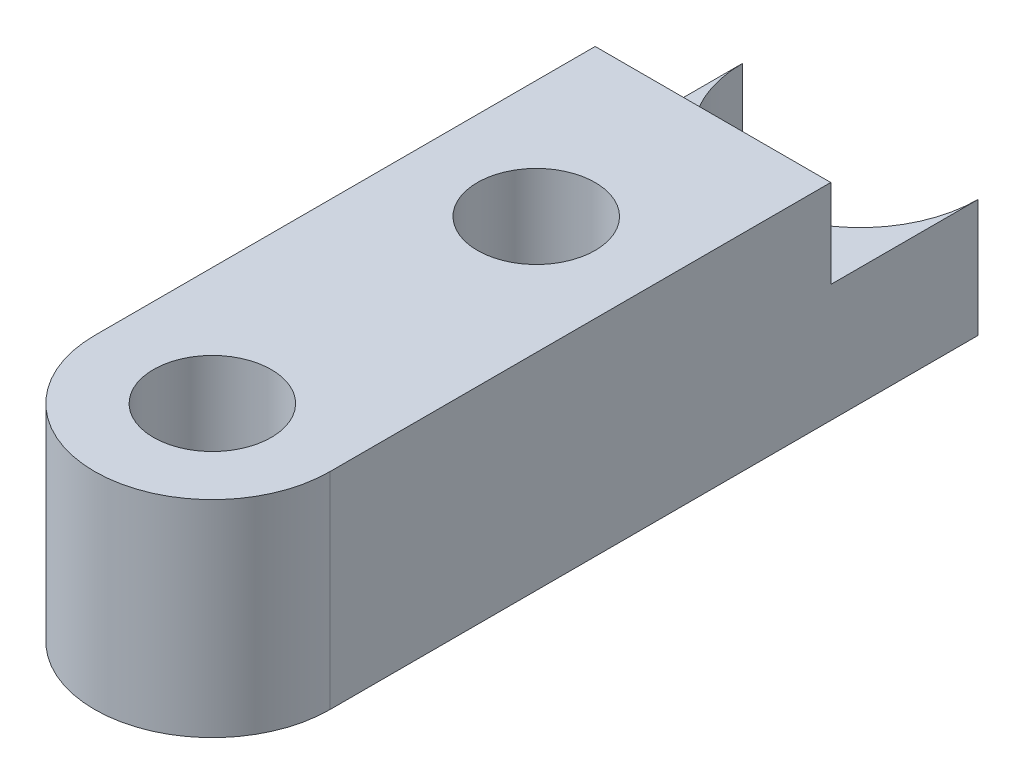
SolidWorks part; units mm, degrees
ref_plane "Front Plane" through (0, 0, 0) normal (0, 0, 1) x (1, 0, 0)
ref_plane "Top Plane" through (0, 0, 0) normal (0, 1, 0) x (1, 0, 0)
ref_plane "Right Plane" through (0, 0, 0) normal (1, 0, 0) x (0, 0, -1)
sketch "Sketch1" plane through (0, 0, 0) normal (0, 1, 0) x (1, 0, 0)
  line L0 (-73.0118, -9.6983) -> (-73.0118, 1.3017)
  line L1 (-77.0118, -9.6983) -> (-73.0118, -9.6983) construction
  line L3 (-77.0118, -9.6983) -> (-77.0118, 1.3017)
  line L5 (-75.0118, -11.6983) -> (-75.0118, 1.3017) construction
  arc A0 (-77.0118, -9.6983) -> (-73.0118, -9.6983) centre (-75.0118, -9.6983) ccw
  circle A3 centre (-75.0118, -9.6983) radius 1
  arc A4 (-77.0118, 1.3017) -> (-73.0118, 1.3017) centre (-75.0118, 1.3017) ccw
  circle A5 centre (-75.0118, -4.1983) radius 1
  point P12 (-75.0118, -4.1983)
  dimension "D2" = 4
  dimension "D6" = 5.5
  dimension "D3" = 4
  dimension "D4" = 2
  dimension "D5" = 2
  dimension "D7" = 2
  dimension "D1" = 11
extrude "Boss-Extrude1" add sketch "Sketch1" along normal blind 3.5
sketch "Sketch2" plane through (0, 3.5, 0) normal (0, 1, 0) x (1, 0, 0)
  line L0 (-73.0118, -9.6983) -> (-73.0118, 1.3017) construction
  line L1 (-77.0118, 1.3017) -> (-73.0118, 1.3017)
  line L2 (-77.0118, 1.3017) -> (-77.0118, -1.1983)
  line L3 (-77.0118, -1.1983) -> (-73.0118, -1.1983)
  line L4 (-73.0118, 1.3017) -> (-73.0118, -1.1983)
  dimension "D1" = 2.5
extrude "Cut-Extrude1" cut sketch "Sketch2" against normal blind 1.5
ref_point "Point1"
